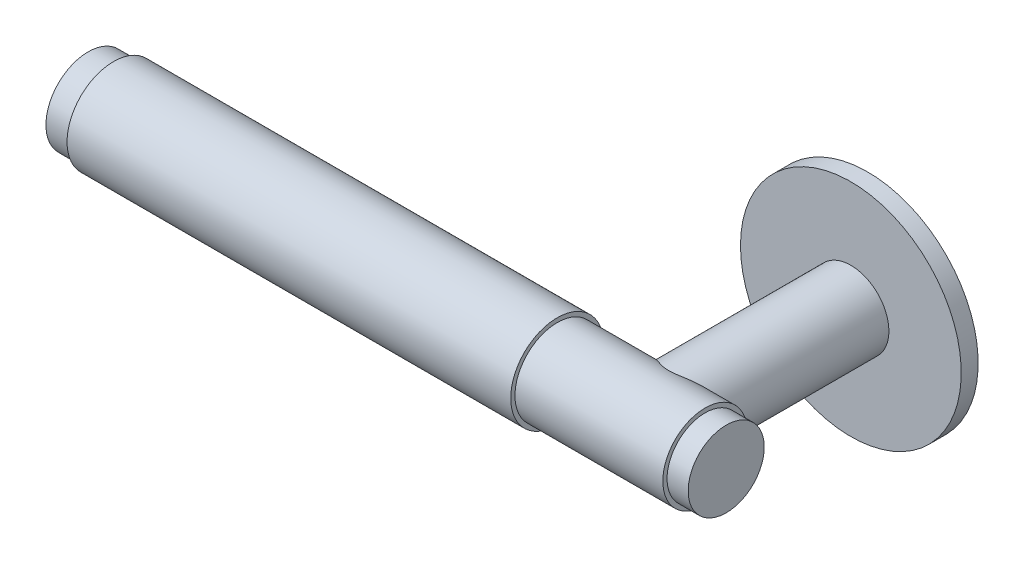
SolidWorks part; units mm, degrees
ref_plane "Front Plane" through (0, 0, 0) normal (0, 0, 1) x (1, 0, 0)
ref_plane "Top Plane" through (0, 0, 0) normal (0, 1, 0) x (1, 0, 0)
ref_plane "Right Plane" through (0, 0, 0) normal (1, 0, 0) x (0, 0, -1)
sketch "Sketch1" plane through (0, 0, 0) normal (0, 0, 1) x (1, 0, 0)
  line L0 (-108.8623, 1.7745) -> (42.1377, 1.7745)
  line L1 (-68.8623, 12.7745) -> (36.1377, 12.7745)
  line L2 (-68.8623, 12.7745) -> (-68.8623, 11.7745)
  line L4 (36.1377, 12.7745) -> (36.1377, 11.7745)
  line L6 (-68.8623, 11.7745) -> (-103.8623, 11.7745) construction
  line L7 (42.1377, 1.7745) -> (42.1377, 11.7745)
  line L8 (42.1377, 11.7745) -> (36.1377, 11.7745)
  line L11 (-103.8623, 11.7745) -> (-68.8623, 11.7745)
  line L12 (-103.8623, 11.7745) -> (-103.8623, 10.7745)
  line L13 (-103.8623, 10.7745) -> (-108.8623, 10.7745) construction
  line L16 (-108.8623, 1.7745) -> (42.1377, 1.7745) construction
  line L19 (-103.8623, 10.7745) -> (-108.8623, 10.7745)
  line L20 (-108.8623, 1.7745) -> (-108.8623, 10.7745)
  dimension "D1" = 105
  dimension "D5" = 6
  dimension "D8" = 35
  dimension "D10" = 1
revolve "Revolve1" add sketch "Sketch1" angle 360 about L0
sketch "Sketch2" plane through (0, 0, 0) normal (0, 0, 1) x (1, 0, 0)
  line L0 (-108.8623, 1.7745) -> (-81.8623, 1.7745) construction
  line L1 (-108.8623, 10.7745) -> (-108.8623, -7.2255) construction
  line L2 (-81.8623, 1.7745) -> (-90.8623, 1.7745) construction
  circle A0 centre (-90.8623, 1.7745) radius 9
extrude "Boss-Extrude1" add sketch "Sketch2" along normal blind 47.5
sketch "Sketch3" plane through (0, 0, 47.5) normal (0, 0, 1) x (1, 0, 0)
  circle A0 centre (-90.8623, 1.7745) radius 26.125
extrude "Boss-Extrude2" add sketch "Sketch3" along normal blind 4
move or copy body "Body-Move/Copy1" bodies to move or copy 103 copy no rotation origin (-37.4248, 0, 20.25) rotation axis (0, 1, 0) rotation angle 180
move or copy body "Body-Move/Copy2" bodies to move or copy 104 copy no translate (0, 0, 11)
